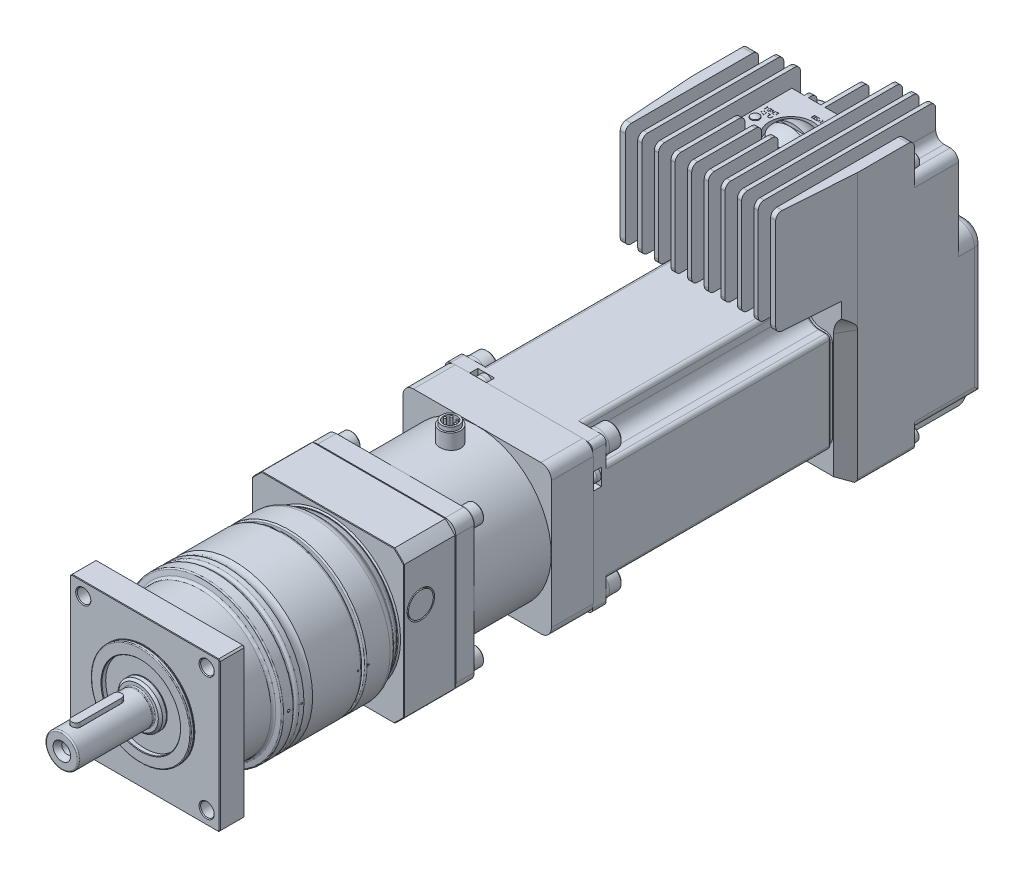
SolidWorks part; units mm, degrees
ref_plane "Front Plane" through (0, 0, 0) normal (0, 0, 1) x (1, 0, 0)
ref_plane "Top Plane" through (0, 0, 0) normal (0, 1, 0) x (1, 0, 0)
ref_plane "Right Plane" through (0, 0, 0) normal (1, 0, 0) x (0, 0, -1)
imported_body "Imported2"
sketch "Sketch1" plane through (0, 0, -9.525) normal (0, 0, -1) x (-1, 0, 0)
  line L4 (28.375, -27.9088) -> (28.375, 27.9088)
  line L5 (27.9088, 28.375) -> (-27.9088, 28.375)
  line L6 (-28.375, 27.9088) -> (-28.375, -27.9088)
  line L7 (-27.9088, -28.375) -> (27.9088, -28.375)
  line L8 (28.375, -27.9088) -> (28.375, 27.9088)
  line L9 (27.9088, 28.375) -> (-27.9088, 28.375)
  line L10 (-28.375, 27.9088) -> (-28.375, -27.9088)
  line L11 (-27.9088, -28.375) -> (27.9088, -28.375)
  arc A4 (28.375, 27.9088) -> (27.9088, 28.375) centre (0, 0) ccw
  arc A5 (-27.9088, 28.375) -> (-28.375, 27.9088) centre (0, 0) ccw
  arc A6 (-28.375, -27.9088) -> (-27.9088, -28.375) centre (0, 0) ccw
  arc A7 (27.9088, -28.375) -> (28.375, -27.9088) centre (0, 0) ccw
  arc A8 (28.375, 27.9088) -> (27.9088, 28.375) centre (0, 0) ccw
  arc A9 (-27.9088, 28.375) -> (-28.375, 27.9088) centre (0, 0) ccw
  arc A10 (-28.375, -27.9088) -> (-27.9088, -28.375) centre (0, 0) ccw
  arc A11 (27.9088, -28.375) -> (28.375, -27.9088) centre (0, 0) ccw
  dimension "D1" = 0
extrude "Cut-Extrude1" cut sketch "Sketch1" along normal blind 0.0025
sketch "Sketch2" plane through (0, 0, -69.9) normal (0, 0, 1) x (1, 0, 0)
  line L4 (25.2478, 28.8) -> (-25.2478, 28.8)
  line L5 (-28.8, 25.2478) -> (-28.8, -25.2478)
  line L6 (-25.2478, -28.8) -> (25.2478, -28.8)
  line L7 (28.8, -25.2478) -> (28.8, 25.2478)
  line L8 (25.2478, 28.8) -> (-25.2478, 28.8)
  line L9 (-28.8, 25.2478) -> (-28.8, -25.2478)
  line L10 (-25.2478, -28.8) -> (25.2478, -28.8)
  line L11 (28.8, -25.2478) -> (28.8, 25.2478)
  arc A4 (-25.2478, 28.8) -> (-28.8, 25.2478) centre (0, 0) ccw
  arc A5 (-28.8, -25.2478) -> (-25.2478, -28.8) centre (0, 0) ccw
  arc A6 (25.2478, -28.8) -> (28.8, -25.2478) centre (0, 0) ccw
  arc A7 (28.8, 25.2478) -> (25.2478, 28.8) centre (0, 0) ccw
  arc A8 (-25.2478, 28.8) -> (-28.8, 25.2478) centre (0, 0) ccw
  arc A9 (-28.8, -25.2478) -> (-25.2478, -28.8) centre (0, 0) ccw
  arc A10 (25.2478, -28.8) -> (28.8, -25.2478) centre (0, 0) ccw
  arc A11 (28.8, 25.2478) -> (25.2478, 28.8) centre (0, 0) ccw
  dimension "D1" = 0
extrude "Cut-Extrude2" cut sketch "Sketch2" along normal blind 0.0025
